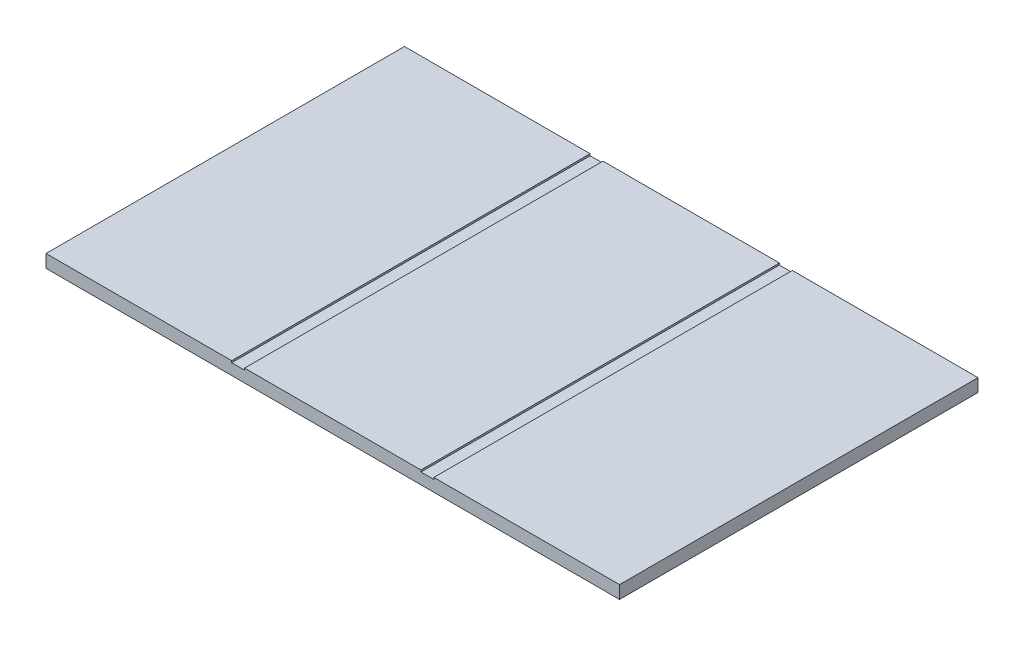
SolidWorks part; units mm, degrees
ref_plane "Plano frontal" through (0, 0, 0) normal (0, 0, 1) x (1, 0, 0)
ref_plane "Plano superior" through (0, 0, 0) normal (0, 1, 0) x (1, 0, 0)
ref_plane "Plano direito" through (0, 0, 0) normal (1, 0, 0) x (0, 0, -1)
sketch "Esboço1" plane through (0, 0, 0) normal (0, 1, 0) x (1, 0, 0)
  line L0 (0, -1000) -> (0, 49000) construction
  line L1 (-1000, 0) -> (49000, 0) construction
  line L2 (-1000, 250) -> (49000, 250) construction
  line L3 (-1000, -250) -> (49000, -250) construction
  line L4 (400, -1000) -> (400, 49000) construction
  line L5 (-400, -1000) -> (-400, 49000) construction
  line L7 (-400, 250) -> (400, 250)
  line L8 (-400, 250) -> (-400, -250)
  line L9 (-400, -250) -> (400, -250)
  line L10 (400, 250) -> (400, -250)
  dimension "D1" = 250
  dimension "D2" = 250
  dimension "D3" = 400
  dimension "D4" = 400
extrude "Ressalto-extrusão1" add sketch "Esboço1" along normal blind 18
sketch "Esboço2" plane through (0, 18, 0) normal (0, 1, 0) x (1, 0, 0)
  line L0 (-400, -926.1868) -> (-400, 49073.8132) construction
  line L2 (400, -962.1932) -> (400, 49037.8068) construction
  line L4 (-387, -926.1868) -> (-387, 49073.8132) construction
  line L5 (387, -962.1932) -> (387, 49037.8068) construction
  line L6 (-141, -926.1868) -> (-141, 49073.8132) construction
  line L7 (141, -962.1932) -> (141, 49037.8068) construction
  line L8 (-123, -926.1868) -> (-123, 49073.8132) construction
  line L9 (123, -962.1932) -> (123, 49037.8068) construction
  line L10 (-1335.7602, 250) -> (48664.2398, 250) construction
  line L12 (-1287.1515, -250) -> (48712.8485, -250) construction
  line L19 (-141, 250) -> (-123, 250)
  line L20 (-141, 250) -> (-141, -250)
  line L21 (-141, -250) -> (-123, -250)
  line L22 (-123, 250) -> (-123, -250)
  line L23 (123, 250) -> (141, 250)
  line L24 (123, 250) -> (123, -250)
  line L25 (123, -250) -> (141, -250)
  line L26 (141, 250) -> (141, -250)
  point P19 (0, 0)
  dimension "D7" = 246
  dimension "D3" = 246
  dimension "D4" = 246
  dimension "D1" = 13
  dimension "D2" = 13
  dimension "D5" = 18
  dimension "D6" = 18
extrude "Corte-extrusão1" cut sketch "Esboço2" against normal blind 2.5
